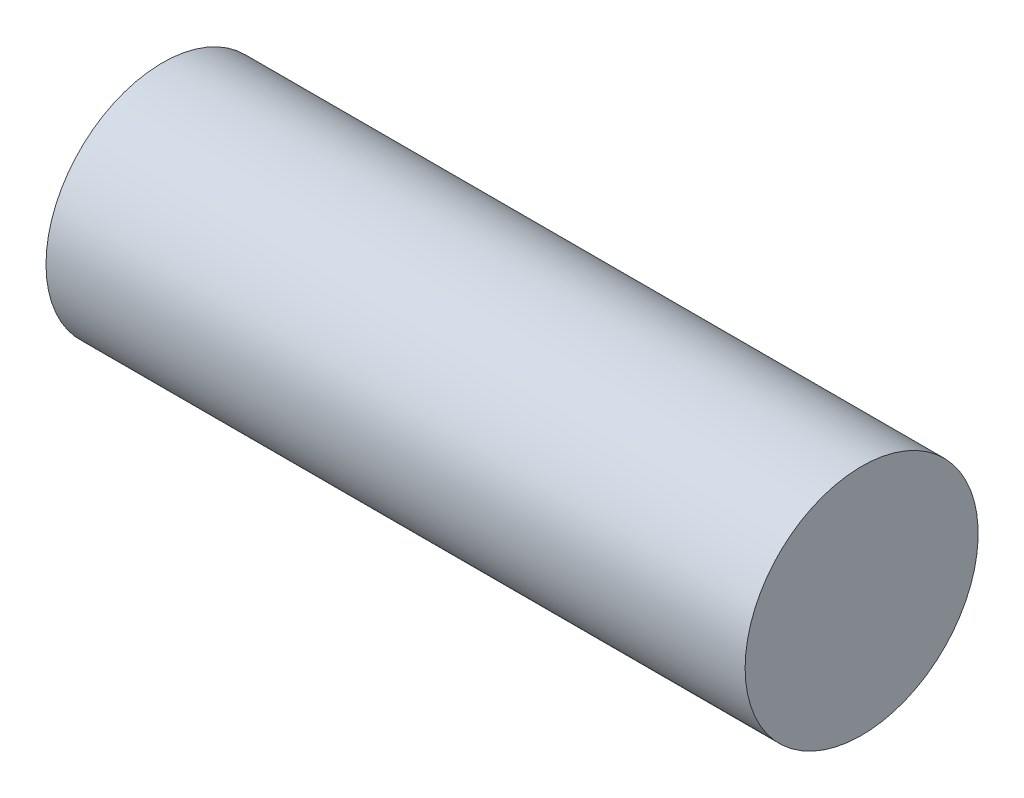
SolidWorks part; units mm, degrees
ref_plane "Front Plane" through (0, 0, 0) normal (0, 0, 1) x (1, 0, 0)
ref_plane "Top Plane" through (0, 0, 0) normal (0, 1, 0) x (1, 0, 0)
ref_plane "Right Plane" through (0, 0, 0) normal (1, 0, 0) x (0, 0, -1)
sketch "Sketch1" plane through (0, 0, 0) normal (1, 0, 0) x (0, 0, -1)
  circle A0 centre (0, 0) radius 7.5
  dimension "D1" = 15
extrude "Boss-Extrude1" add sketch "Sketch1" along normal blind 45
